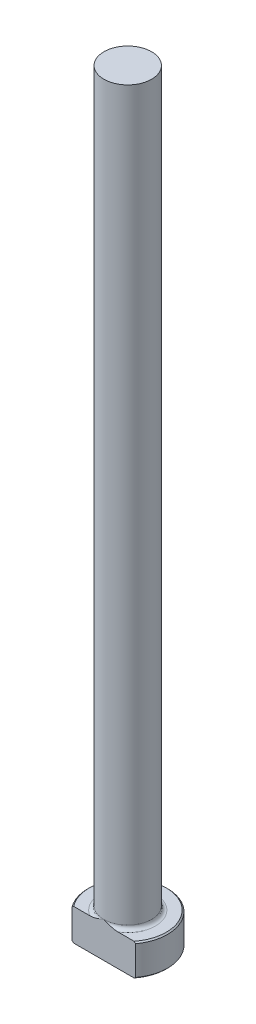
SolidWorks part; units mm, degrees
ref_plane "Front Plane" through (0, 0, 0) normal (0, 0, 1) x (1, 0, 0)
ref_plane "Top Plane" through (0, 0, 0) normal (0, 1, 0) x (1, 0, 0)
ref_plane "Right Plane" through (0, 0, 0) normal (1, 0, 0) x (0, 0, -1)
sketch "Sketch1" plane through (0, 0, 0) normal (0, 0, 1) x (1, 0, 0)
  line L0 (0, 259.9588) -> (0, -15.1925) construction
  line L1 (0, 0) -> (-7.9375, 0)
  line L2 (-7.9375, 0) -> (-7.9375, 6.35)
  line L3 (-7.9375, 6.35) -> (-4.7625, 6.35)
  line L4 (-4.7625, 6.35) -> (-4.7625, 152.4)
  line L5 (-4.7625, 152.4) -> (0, 152.4)
  line L6 (0, 152.4) -> (0, 0)
  dimension "L" = 152.4
  dimension "H" = 15.875
  dimension "T" = 6.35
  dimension "D" = 9.525
revolve "Revolve1" add sketch "Sketch1" angle 360 about L0
chamfer "Chamfer1" distance 0.254 angle 45 2 edges at (0, 6.35, 7.9375) (0, 0, 7.9375)
fillet "Fillet1" radius 0.762 1 edges at (0, 6.35, 4.7625)
sketch "Sketch2" plane through (0, 0, 0) normal (0, -1, 0) x (1, 0, 0)
  line L0 (-6.35, 4.7625) -> (6.35, 4.7625)
  arc A0 (6.35, 4.7625) -> (-6.35, 4.7625) centre (0, 0) ccw
  circle A1 centre (0, 0) radius 7.9375 construction
  circle A3 centre (0, 0) radius 4.7625 construction
extrude "KEY" cut sketch "Sketch2" against normal through all
sketch "Pocket Sketch" plane through (0, 0, 0) normal (0, 0, 1) x (1, 0, 0)
  line L0 (-8.3344, 0) -> (-8.3344, 6.3754)
  line L1 (-8.3344, 6.3754) -> (-5.9214, 6.3754)
  line L2 (-5.1594, 7.1374) -> (-5.1594, 22.225)
  line L3 (-5.1594, 22.225) -> (0, 22.225)
  line L4 (0, 22.225) -> (0, 0)
  line L5 (0, 0) -> (-8.3344, 0)
  line L6 (0, 12.6104) -> (0, -2.4989) construction
  line L7 (-7.9375, 6.096) -> (-7.9375, 0.254) construction
  line L8 (7.6835, 6.35) -> (-7.6835, 6.35) construction
  line L9 (-4.7625, 152.4) -> (-4.7625, 7.112) construction
  line L10 (-5.9214, 6.3754) -> (-5.1594, 7.1374)
  point P3 (-5.1594, 6.3754)
  dimension "D1" = 16.6687
  dimension "D2" = 0.3969
  dimension "D3" = 0.0254
  dimension "D4" = 0.3969
  dimension "D5" = 10.3187
  dimension "D6" = 22.225
